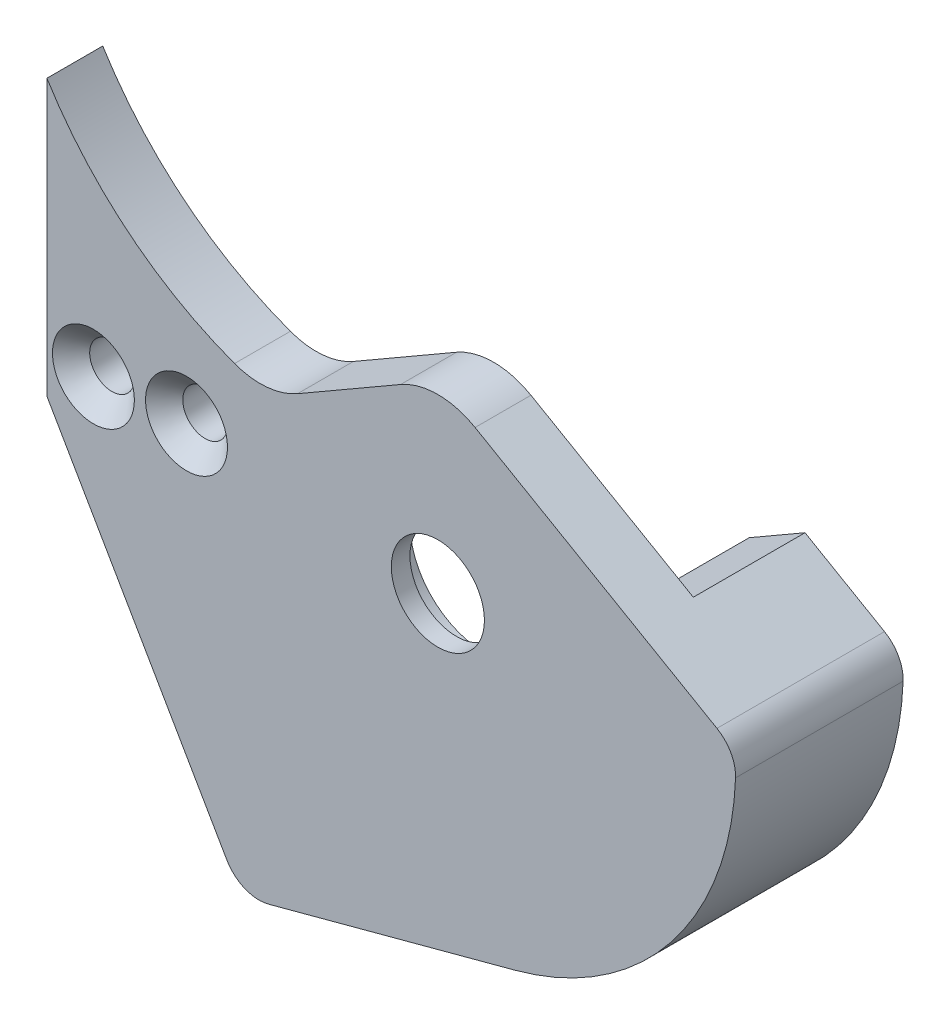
SolidWorks part; units mm, degrees
ref_plane "Plan de face" through (0, 0, 0) normal (0, 0, 1) x (1, 0, 0)
ref_plane "Plan de dessus" through (0, 0, 0) normal (0, 1, 0) x (1, 0, 0)
ref_plane "Plan de droite" through (0, 0, 0) normal (1, 0, 0) x (0, 0, -1)
sketch "Esquisse1" plane through (0, 0, 0) normal (0, 0, 1) x (1, 0, 0)
  line L0 (18, 42.1769) -> (27.6668, 25.4335)
  line L1 (29.9165, 24.5017) -> (43.1411, 28.0452)
  line L4 (49.7205, 47.1852) -> (53.9906, 44.7198)
  line L6 (21.3425, 42.3875) -> (29.1139, 28.9271)
  line L7 (31.3636, 27.9952) -> (42.3646, 30.943)
  line L8 (46.7205, 45.4531) -> (50.7919, 43.1025)
  line L9 (46.7205, 45.4531) -> (49.7205, 47.1852)
  line L12 (48.2205, 48.0512) -> (54.987, 44.1445) construction
  line L13 (28.4341, 24.1045) -> (43.1411, 28.0452) construction
  line L14 (18, 42.1769) -> (28.4341, 24.1045) construction
  line L15 (46.7205, 45.4531) -> (51.9559, 42.4304) construction
  line L16 (29.8812, 27.598) -> (42.3646, 30.943) construction
  line L17 (20.5981, 43.6769) -> (29.8812, 27.598) construction
  line L18 (18, 42.1769) -> (21.3425, 42.3875)
  arc A0 (43.1411, 28.0452) -> (54.9893, 42.9146) centre (39, 43.5) ccw
  arc A1 (42.3646, 30.943) -> (51.7541, 40.9832) centre (39, 43.5) ccw
  arc A2 (43.1411, 28.0452) -> (54.987, 44.1445) centre (39, 43.5) ccw construction
  arc A3 (53.9906, 44.7198) -> (54.9893, 42.9146) centre (52.9906, 42.9877) cw
  arc A4 (29.9165, 24.5017) -> (27.6668, 25.4335) centre (29.3989, 26.4335) cw
  arc A5 (42.3646, 30.943) -> (51.9559, 42.4304) centre (39, 43.5) ccw construction
  arc A6 (50.7919, 43.1025) -> (51.7541, 40.9832) centre (49.7919, 41.3704) cw
  arc A7 (31.3636, 27.9952) -> (29.1139, 28.9271) centre (30.8459, 29.9271) cw
  dimension "D1" = 16
  dimension "D6" = 2
  dimension "D5" = 3
extrude "Boss.-Extru.1" add sketch "Esquisse1" along normal blind 6
sketch "Esquisse2" plane through (0, 0, 6) normal (0, 0, 1) x (1, 0, 0)
  line L0 (18, 42.1769) -> (27.6668, 25.4335)
  line L1 (29.9165, 24.5017) -> (43.1411, 28.0452)
  line L3 (18, 42.1769) -> (18, 56.9643)
  line L4 (39, 53.3746) -> (53.9906, 44.7198)
  line L11 (39, 53.3746) -> (29.9481, 48.1485)
  arc A0 (43.1411, 28.0452) -> (54.9893, 42.9146) centre (39, 43.5) ccw
  arc A1 (18, 56.9643) -> (29.9481, 48.1485) centre (35, 67.5) ccw
  circle A2 centre (39, 43.5) radius 2.5
  arc A3 (53.9906, 44.7198) -> (54.9893, 42.9146) centre (52.9906, 42.9877) cw
  arc A4 (29.9165, 24.5017) -> (27.6668, 25.4335) centre (29.3989, 26.4335) cw
  arc A6 (43.1411, 28.0452) -> (54.9893, 42.9146) centre (39, 43.5) ccw construction
  point P2 (41.6416, 38.1073)
  point P12 (34.3475, 42.3185)
  dimension "D6" = 2
  dimension "D2" = 20
extrude "Boss.-Extru.2" add sketch "Esquisse2" along normal blind 3
sketch "Esquisse3" plane through (31.7631, 18.3385, 0) normal (-0.866, -0.5, 0) x (0, 0, 1)
  line L0 (9, 27.5263) -> (9, 8.1927) construction
  line L1 (6, 27.5263) -> (0, 27.5263) construction
  circle A0 centre (2, 18.5263) radius 3
  dimension "D1" = 6
  dimension "D2" = 7
  dimension "D3" = 9
extrude "Enlèv. mat.-Extru.1" cut sketch "Esquisse3" against normal blind 3
fillet "Congé1" radius 4 2 edges at (39, 53.3746, 7.5) (29.9481, 48.1485, 7.5)
sketch "Esquisse4" plane through (0, 0, 6) normal (0, 0, -1) x (-1, 0, 0)
  circle A0 centre (-39, 43.5) radius 4
  dimension "D1" = 8
extrude "Enlèv. mat.-Extru.2" cut sketch "Esquisse4" against normal blind 2
sketch "Esquisse7" plane through (0, 0, 9) normal (0, 0, 1) x (1, 0, 0)
  line L0 (18.9202, 44.2389) -> (28.5553, 44.8459) construction
  line L1 (21.3425, 42.3875) -> (18, 42.1769) construction
  dimension "D1" = 2
hole_wizard "Fraisage pour vis à tête fraisée M21" positions "Esquisse9" profile "Esquisse8" countersink size "M2" standard "Iso"
sketch "Esquisse9" plane through (0, 0, 9) normal (0, 0, 1) x (1, 0, 0)
  line L0 (18.9202, 44.2389) -> (28.5553, 44.8459) construction
  line L1 (18, 56.9643) -> (18, 42.1769) construction
  point P0 (20.5, 44.3384)
  point P2 (25.5, 44.6534)
  dimension "D1" = 2.5
  dimension "D2" = 7.5
sketch "Esquisse8" plane through (20.5, 44.3384, 9) normal (1, 0, 0) x (0, -1, 0)
  line L0 (0, 0) -> (0, 9)
  line L1 (0, 9) -> (1.2, 9)
  line L2 (1.2, 9) -> (1.2, 1)
  line L3 (1.2, 1) -> (2.2, 0)
  line L5 (2.2, 0) -> (0, 0)
  line L6 (-1.2, 1) -> (-2.2, 0) construction
  line L11 (0, -6.35) -> (0, 107.95) construction
  dimension "Diamètre du perçage jusqu'au prochain" = 2.4
  dimension "Profondeur du perçage jusqu'au prochain" = 9
  dimension "Diamètre du fraisage entrant" = 4.4
  dimension "Angle du fraisage entrant" = 90
sketch "Esquisse10" plane through (0, 0, 6) normal (0, 0, -1) x (-1, 0, 0)
  circle A0 centre (-39, 43.5) radius 6
  dimension "D1" = 12
extrude "Enlèv. mat.-Extru.3" cut sketch "Esquisse10" against normal blind 0.5
